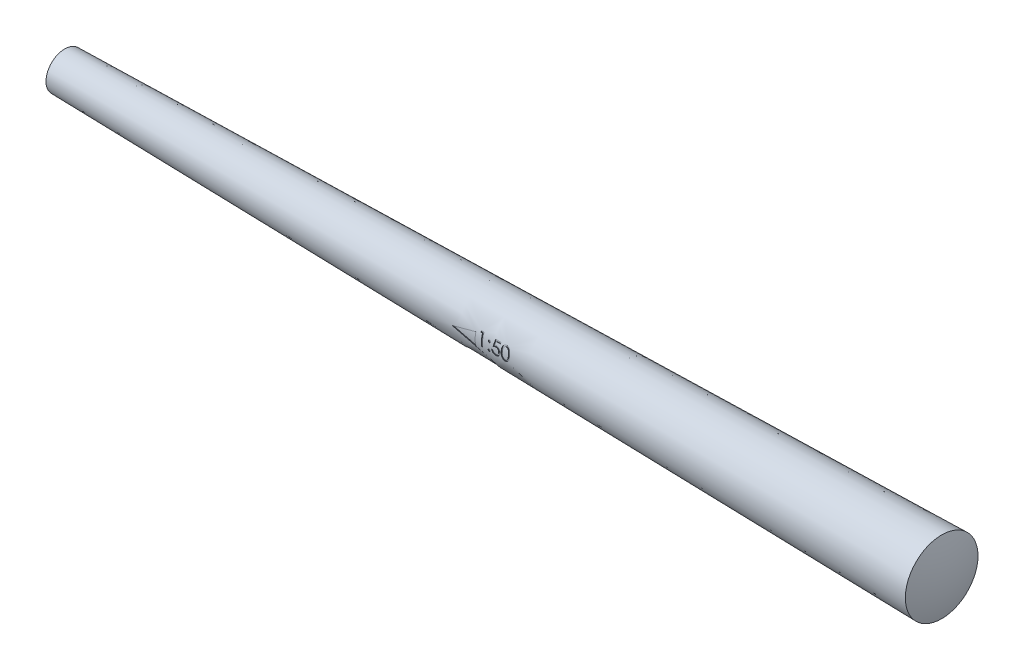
SolidWorks part; units mm, degrees
ref_plane "Front Plane" through (0, 0, 0) normal (0, 0, 1) x (1, 0, 0)
ref_plane "Top Plane" through (0, 0, 0) normal (0, 1, 0) x (1, 0, 0)
ref_plane "Right Plane" through (0, 0, 0) normal (1, 0, 0) x (0, 0, -1)
sketch "Sketch1" plane through (0, 0, 0) normal (1, 0, 0) x (0, 0, -1)
  circle A0 centre (0, 0) radius 1.5
  dimension "D1" = 3
extrude "Extrude1" add sketch "Sketch1" along normal mid plane 70
draft "Draft1" type of draft neutral plane draft angle 1.146 faces to draft 1 parameters "D1"=1.146
sketch "Sketch2" plane through (0, 0, 0) normal (0, 0, 1) x (1, 0, 0)
  line L0 (-35, 0) -> (-35, 1.5)
  line L1 (-35, 1.5) -> (-35, -1.5) construction
  line L2 (-35, 0) -> (-35.45, 0)
  line L3 (-35.45, 0) -> (-35.45, -2.2) construction
  line L4 (35, 0) -> (35, 2.9)
  line L5 (35, -2.9) -> (35, 2.9) construction
  line L6 (35, 0) -> (35.45, 0)
  line L7 (35.45, 0) -> (35.45, -2.2) construction
  line L8 (-35, -1.5) -> (35, -2.9) construction
  arc A0 (-35.45, 0) -> (-35, 1.5) centre (-32.725, 0) cw
  arc A1 (35.45, 0) -> (35, 2.9) centre (25.8803, 0) ccw
  point P14 (0, -2.2)
revolve "Revolve1" add sketch "Sketch2" angle 360 about L2
sketch "Sketch5" plane through (0, 0, 0) normal (0, 0, 1) x (1, 0, 0)
  line L0 (0, 2.2) -> (0, -2.2) construction
  line L1 (35, 2.9) -> (-35, 1.5) construction
  line L2 (-35, -1.5) -> (35, -2.9) construction
ref_plane "Plane2" through (0, 0, 0) normal (-0.02, 0, 0.9998) x (0.9998, 0, 0.02)
sketch "Sketch6" plane through (0, 0, 0) normal (-0.02, 0, 0.9998) x (0.9998, 0, 0.02)
  line L0 (0, 0) -> (0, 0.5)
  line L1 (0, 2.2) -> (0, -2.2) construction
  line L2 (0, 0.5) -> (-1.866, 0)
  line L3 (-1.866, 0) -> (0, -0.5)
  line L4 (0, -0.5) -> (0, 0)
  line L5 (0, -0.25) -> (3, -0.25) construction
  text T0 "1:50" font "Century Gothic" height 1
  dimension "D1" = 1
  dimension "D2" = 30
  dimension "D3" = 3
wrap "Wrap2" sketch "Sketch6" wrap type deboss source sketch "Sketch6" thickness 0.05 parameters "D1"=0.05
equation "\"D2@Sketch2\" = \"D1@Sketch2\""
